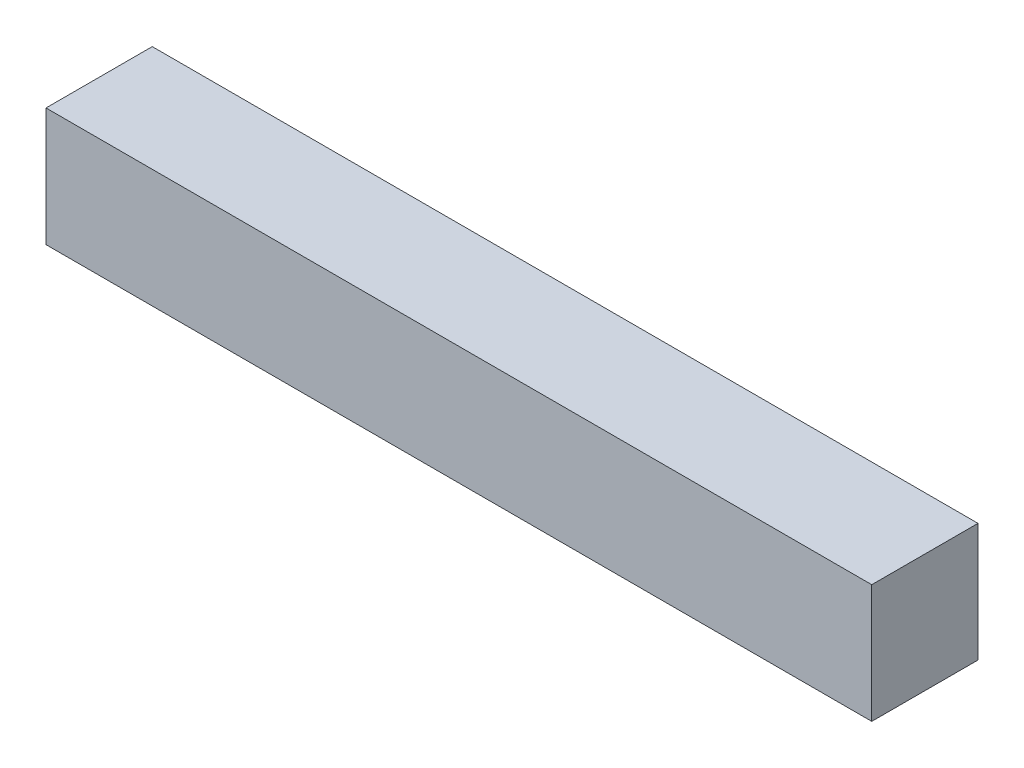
SolidWorks part; units mm, degrees
ref_plane "Front Plane" through (0, 0, 0) normal (0, 0, 1) x (1, 0, 0)
ref_plane "Top Plane" through (0, 0, 0) normal (0, 1, 0) x (1, 0, 0)
ref_plane "Right Plane" through (0, 0, 0) normal (1, 0, 0) x (0, 0, -1)
sketch "Sketch1" plane through (0, 0, 0) normal (0, 0, 1) x (1, 0, 0)
  line L1 (-125.6225, 35.1379) -> (146.3775, 35.1379)
  line L2 (-125.6225, 35.1379) -> (-125.6225, -3.8621)
  line L3 (-125.6225, -3.8621) -> (146.3775, -3.8621)
  line L4 (146.3775, 35.1379) -> (146.3775, -3.8621)
  dimension "D1" = 272
  dimension "D2" = 39
extrude "Boss-Extrude2" add sketch "Sketch1" along normal blind 35
sketch "Sketch2" plane through (0, 0, 35) normal (0, 0, 1) x (1, 0, 0)
  text T0 "37V Battery" font "Century Gothic" height in points 24
